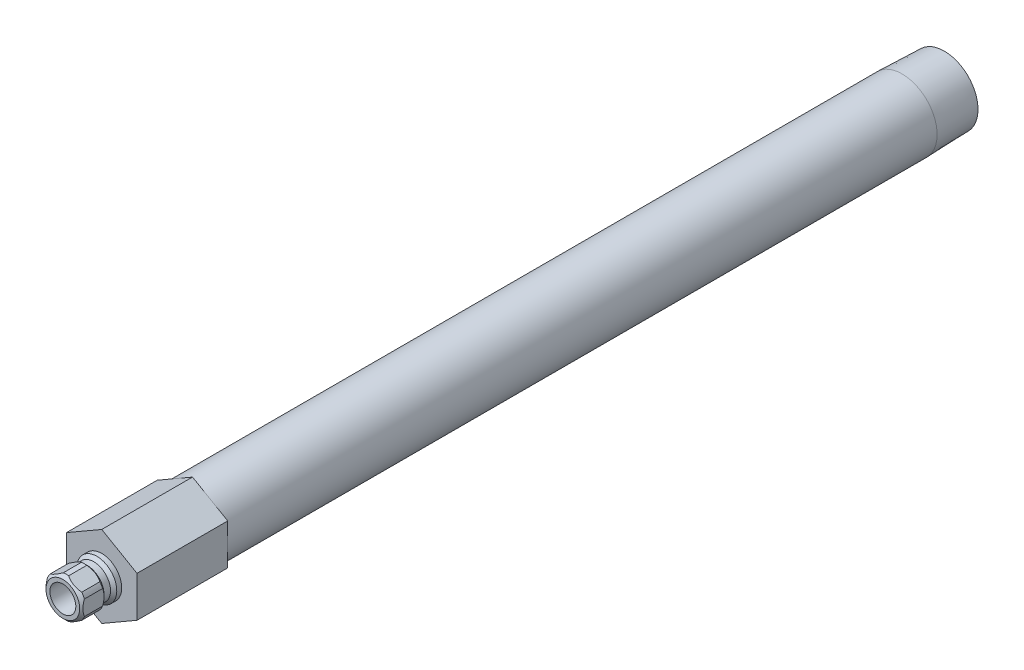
SolidWorks part; units mm, degrees
ref_plane "Front Plane" through (0, 0, 0) normal (0, 0, 1) x (1, 0, 0)
ref_plane "Top Plane" through (0, 0, 0) normal (0, 1, 0) x (1, 0, 0)
ref_plane "Right Plane" through (0, 0, 0) normal (1, 0, 0) x (0, 0, -1)
sketch "Sketch1" plane through (0, 0, 0) normal (1, 0, 0) x (0, 0, -1)
  line L0 (0, 0) -> (-12.7, 0) construction
  line L1 (-9.525, 3.175) -> (-9.525, 4.1275)
  line L2 (-3.556, 4.1275) -> (-3.556, 0) construction
  line L3 (-8.763, 4.8895) -> (-4.318, 4.8895)
  line L4 (0, 8.5725) -> (0, 0) construction
  line L5 (-3.556, 4.1275) -> (-1.9685, 4.1275)
  line L6 (-1.2065, 4.8895) -> (0, 4.8895)
  line L7 (0, 4.8895) -> (0, 8.5725)
  line L8 (-3.556, 4.1275) -> (-4.318, 4.8895)
  line L9 (-1.9685, 4.1275) -> (-1.2065, 4.8895)
  line L10 (-9.525, 4.1275) -> (-8.763, 4.8895)
  line L11 (-9.525, 3.175) -> (22.225, 3.175)
  line L12 (0, 8.5725) -> (196.0372, 8.5725)
  line L13 (196.0372, 8.5725) -> (206.375, 8.2494)
  line L14 (206.375, 8.2494) -> (206.375, 6.2611)
  line L15 (0, 0) -> (22.225, 0) construction
  line L16 (22.225, 0) -> (22.225, 3.175) construction
  line L17 (22.225, 4.8895) -> (0, 4.8895) construction
  line L18 (22.225, 3.175) -> (22.225, 6.2611)
  line L19 (22.225, 6.2611) -> (206.375, 6.2611)
  line L20 (22.225, 3.175) -> (22.225, 4.8895) construction
  dimension "D1" = 9.525
  dimension "D2" = 1.5875
  dimension "D3" = 0.762
  dimension "D4" = 45
  dimension "D5" = 5.969
  dimension "D6" = 45
  dimension "D7" = 1.79
  dimension "D8" = 10.3378
  dimension "D9" = 215.9
  dimension "D10" = 3.175
  dimension "D11" = 31.75
  dimension "D12" = 6.35
  dimension "D13" = 12.5222
  dimension "D14" = 9.779
  dimension "D15" = 17.145
revolve "Revolve1" add sketch "Sketch1" angle 360 about L0
sketch "Sketch2" plane through (0, 0, 0) normal (0, 0, 1) x (1, 0, 0)
  line L1 (-8.636, 4.986) -> (-8.636, -4.986)
  line L2 (-8.636, -4.986) -> (0, -9.972)
  line L3 (0, -9.972) -> (8.636, -4.986)
  line L4 (8.636, -4.986) -> (8.636, 4.986)
  line L5 (8.636, 4.986) -> (0, 9.972)
  line L6 (0, 9.972) -> (-8.636, 4.986)
  circle A0 centre (0, 0) radius 8.636 construction
  circle A1 centre (0, 0) radius 3.175 construction
  circle A2 centre (0, 0) radius 3.175
  dimension "D1" = 17.272
extrude "Boss-Extrude1" add sketch "Sketch2" against normal up to vertex (22.225 mm away) from vertex at 0
sketch "Sketch3" plane through (0, 0, 0) normal (0, 0, 1) x (1, 0, 0)
  line L1 (4.5212, 2.6103) -> (0, 5.2206)
  line L2 (0, 5.2206) -> (-4.5212, 2.6103)
  line L3 (-4.5212, 2.6103) -> (-4.5212, -2.6103)
  line L4 (-4.5212, -2.6103) -> (0, -5.2206)
  line L5 (0, -5.2206) -> (4.5212, -2.6103)
  line L6 (4.5212, -2.6103) -> (4.5212, 2.6103)
  circle A0 centre (0, 0) radius 4.5212 construction
  dimension "D1" = 9.0424
extrude "Cut-Extrude1" cut sketch "Sketch3" along normal through all from vertex at 3.556 flip side to cut
